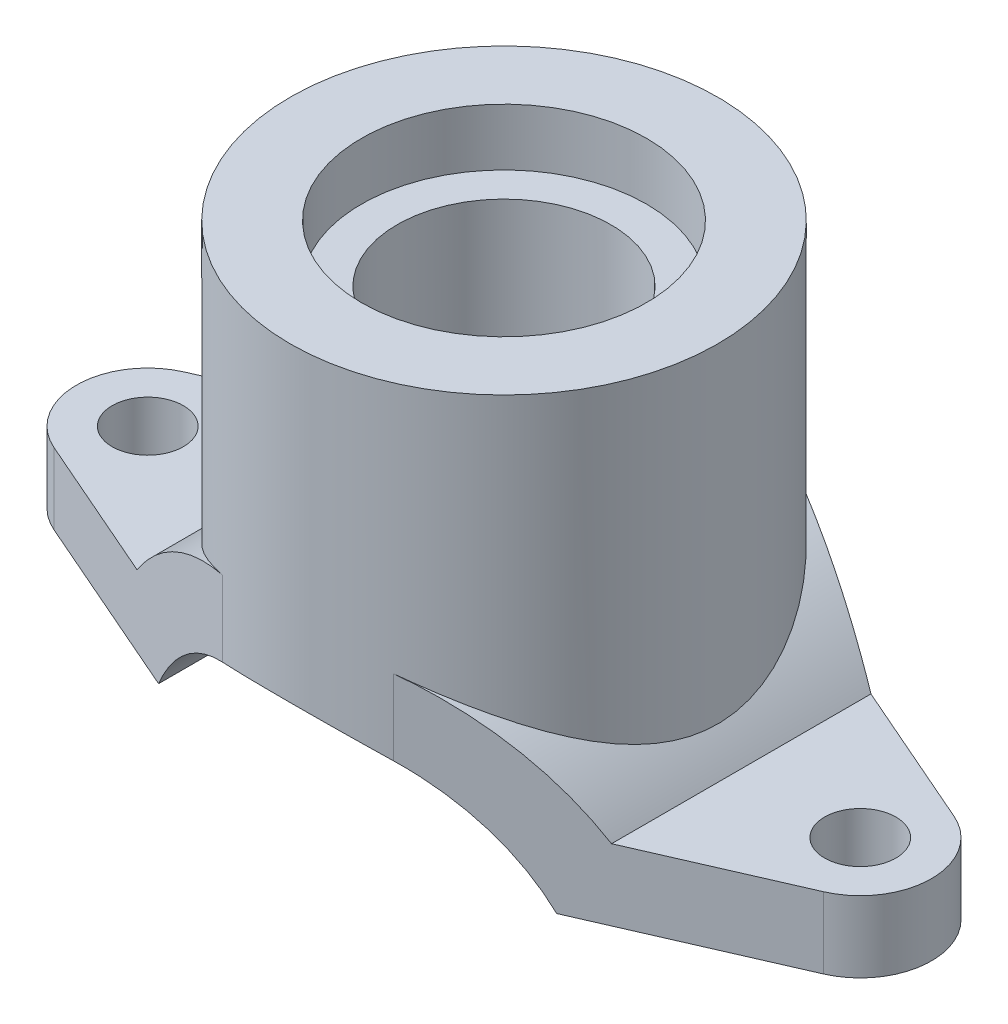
SolidWorks part; units mm, degrees
ref_plane "Front Plane" through (0, 0, 0) normal (0, 0, 1) x (1, 0, 0)
ref_plane "Top Plane" through (0, 0, 0) normal (0, 1, 0) x (1, 0, 0)
ref_plane "Right Plane" through (0, 0, 0) normal (1, 0, 0) x (0, 0, -1)
sketch "Sketch1" plane through (0, 0, 0) normal (0, 0, 1) x (1, 0, 0)
  line L0 (-69.8498, 0) -> (-150, 0)
  line L1 (-150, 0) -> (-150, 25)
  line L2 (-150, 25) -> (-83.2406, 25)
  line L3 (83.2406, 25) -> (150, 25)
  line L4 (150, 25) -> (150, 0)
  line L5 (150, 0) -> (69.8498, 0)
  arc A0 (-69.8498, 0) -> (69.8498, 0) centre (0, -39) cw
  arc A1 (-83.2406, 25) -> (83.2406, 25) centre (0, -39) cw
  dimension "D1" = 80
  dimension "D5" = 105
  dimension "D2" = 39
  dimension "D3" = 300
  dimension "D4" = 25
extrude "Extrude1" add sketch "Sketch1" along normal mid plane 150
ref_plane "Plane1" through (0, 66, 75) normal (0, 1, 0) x (-1, 0, 0)
sketch "Sketch2" plane through (0, 66, 75) normal (0, 1, 0) x (-1, 0, 0)
  line L0 (-150, 0) -> (-150, -150) construction
  line L1 (150, 0) -> (150, -150) construction
  line L3 (-135, -52.0871) -> (-30, -6.2614)
  line L4 (-135, -97.9129) -> (-30, -143.7386)
  line L5 (135, -52.0871) -> (30, -6.2614)
  line L6 (135, -97.9129) -> (30, -143.7386)
  arc A0 (-30, -143.7386) -> (30, -143.7386) centre (0, -75) ccw
  arc A1 (-135, -52.0871) -> (-135, -97.9129) centre (-125, -75) ccw
  arc A2 (135, -97.9129) -> (135, -52.0871) centre (125, -75) ccw
  arc A3 (30, -6.2614) -> (-30, -6.2614) centre (0, -75) ccw
  dimension "D1" = 75
  dimension "D2" = 50
extrude "Extrude2" cut sketch "Sketch2" against normal through all flip side to cut
ref_plane "Plane2" through (0, 150, 0) normal (0, 1, 0) x (-1, 0, 0)
sketch "Sketch3" plane through (0, 150, 0) normal (0, 1, 0) x (-1, 0, 0)
  circle A0 centre (0, 0) radius 75
  arc A1 (30, 68.7386) -> (-30, 68.7386) centre (0, 0) ccw construction
extrude "Extrude3" add sketch "Sketch3" against normal up to surface (84 mm away)
sketch "Sketch4" plane through (0, 0, 0) normal (0, 0, 1) x (1, 0, 0)
  line L0 (0, 0) -> (0, 150)
  line L1 (75, 150) -> (-75, 150) construction
  line L2 (0, 150) -> (50, 150)
  line L3 (50, 150) -> (50, 130)
  line L4 (50, 130) -> (37.5, 130)
  line L5 (37.5, 130) -> (37.5, 0)
  line L6 (37.5, 0) -> (0, 0)
  line L7 (0, 186.1768) -> (0, 0) construction
  dimension "D1" = 100
  dimension "D2" = 75
  dimension "D3" = 20
revolve "Cut-Revolve1" cut sketch "Sketch4" angle 360 about L7
sketch "Sketch6" plane through (0, 25, 0) normal (0, 1, 0) x (1, 0, 0)
  circle A0 centre (-125, 0) radius 12.5
  circle A1 centre (125, 0) radius 12.5
  arc A2 (-135, 22.9129) -> (-135, -22.9129) centre (-125, 0) ccw construction
  arc A3 (135, -22.9129) -> (135, 22.9129) centre (125, 0) ccw construction
  dimension "D1" = 25
extrude "Extrude4" cut sketch "Sketch6" against normal through all
